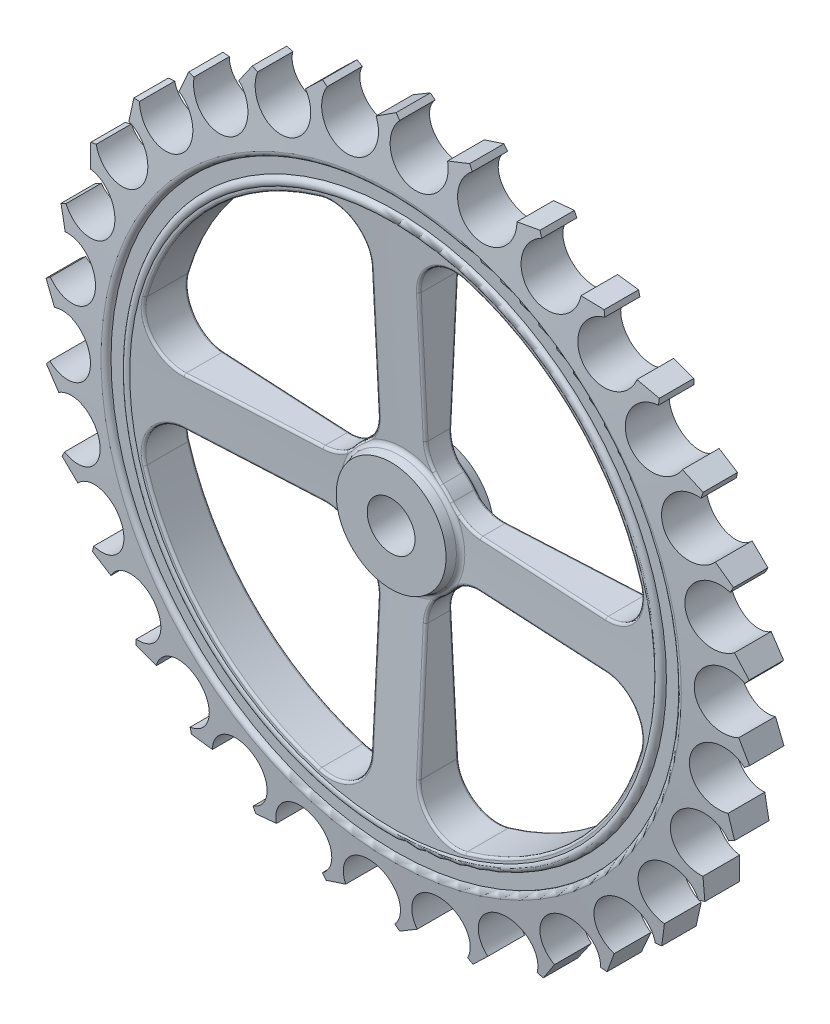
SolidWorks part; units mm, degrees
ref_plane "Спереди" through (0, 0, 0) normal (0, 0, 1) x (1, 0, 0)
ref_plane "Сверху" through (0, 0, 0) normal (0, 1, 0) x (1, 0, 0)
ref_plane "Справа" through (0, 0, 0) normal (1, 0, 0) x (0, 0, -1)
sketch "Эскиз3" plane through (0, 0, 0) normal (1, 0, 0) x (0, 0, -1)
  line L0 (-28.3366, 0) -> (46.3149, 0) construction
  line L1 (5, 5) -> (-5, 5)
  line L2 (0, 5) -> (0, 73.99) construction
  line L3 (-3.6, 73.99) -> (3.6, 73.99)
  line L4 (3.6, 73.99) -> (4.9945, 60.722)
  line L5 (4, 59.6175) -> (4, 56.6175)
  line L6 (5, 5) -> (5, 11.5)
  line L7 (5, 11.5) -> (3.2898, 11.9583)
  line L8 (2.5499, 12.9765) -> (4.75, 54.956)
  line L9 (5, 55.6175) -> (5, 53.7135) construction
  line L10 (4.75, 55.6175) -> (4.75, 53.7135) construction
  line L11 (-3.6, 73.99) -> (-4.9945, 60.722)
  line L12 (-4, 59.6175) -> (-4, 56.6175)
  line L13 (-2.5499, 12.9765) -> (-4.75, 54.956)
  line L14 (-5, 11.5) -> (-3.2898, 11.9583)
  line L15 (-5, 5) -> (-5, 11.5)
  arc A0 (4, 59.6175) -> (4.9945, 60.722) centre (4, 60.6175) ccw
  arc A1 (4.75, 54.956) -> (4, 56.6175) centre (4, 55.6175) ccw
  arc A2 (2.5499, 12.9765) -> (3.2898, 11.9583) centre (3.5486, 12.9242) ccw
  arc A3 (-4, 59.6175) -> (-4.9945, 60.722) centre (-4, 60.6175) cw
  arc A4 (-4.75, 54.956) -> (-4, 56.6175) centre (-4, 55.6175) cw
  arc A5 (-2.5499, 12.9765) -> (-3.2898, 11.9583) centre (-3.5486, 12.9242) cw
  dimension "D8" = 2
  dimension "D13" = 2
  dimension "D1" = 73.99
  dimension "D2" = 5
  dimension "D3" = 6
  dimension "D4" = 3.6
  dimension "D5" = 5
  dimension "D6" = 4
  dimension "D7" = 3
  dimension "D9" = 6.5
  dimension "D10" = 15
  dimension "D11" = 3
  dimension "D12" = 0.25
revolve "Повернуть1" add sketch "Эскиз3" angle 360 about L0
sketch "Эскиз4" plane through (0, 0, 0) normal (0, 0, 1) x (1, 0, 0)
  line L0 (0, 93.8581) -> (0, -85.0976) construction
  line L1 (-81.3467, 0) -> (83.0773, 0) construction
  line L2 (5, 44.1248) -> (5, 16.4924)
  line L3 (16.4924, 5) -> (44.1248, 5)
  line L4 (44.1248, -5) -> (16.4924, -5)
  line L5 (5, -16.4924) -> (5, -44.1248)
  line L6 (-5, -44.1248) -> (-5, -16.4924)
  line L7 (-16.4924, -5) -> (-44.1248, -5)
  line L8 (-44.1248, 5) -> (-16.4924, 5)
  line L9 (-5, 16.4924) -> (-5, 44.1248)
  arc A1 (51.7987, 15.2609) -> (15.2609, 51.7987) centre (0, 0) ccw
  arc A2 (10.2096, 8.0476) -> (8.0476, 10.2096) centre (0, 0) ccw
  arc A3 (5, 44.1248) -> (15.2609, 51.7987) centre (13, 44.1248) cw
  arc A4 (44.1248, 5) -> (51.7987, 15.2609) centre (44.1248, 13) ccw
  arc A5 (16.4924, 5) -> (10.2096, 8.0476) centre (16.4924, 13) cw
  arc A6 (5, 16.4924) -> (8.0476, 10.2096) centre (13, 16.4924) ccw
  arc A7 (15.2609, -51.7987) -> (51.7987, -15.2609) centre (0, 0) ccw
  arc A8 (8.0476, -10.2096) -> (10.2096, -8.0476) centre (0, 0) ccw
  arc A9 (44.1248, -5) -> (51.7987, -15.2609) centre (44.1248, -13) cw
  arc A10 (5, -44.1248) -> (15.2609, -51.7987) centre (13, -44.1248) ccw
  arc A11 (5, -16.4924) -> (8.0476, -10.2096) centre (13, -16.4924) cw
  arc A12 (16.4924, -5) -> (10.2096, -8.0476) centre (16.4924, -13) ccw
  arc A13 (-51.7987, -15.2609) -> (-15.2609, -51.7987) centre (0, 0) ccw
  arc A14 (-10.2096, -8.0476) -> (-8.0476, -10.2096) centre (0, 0) ccw
  arc A15 (-5, -44.1248) -> (-15.2609, -51.7987) centre (-13, -44.1248) cw
  arc A16 (-44.1248, -5) -> (-51.7987, -15.2609) centre (-44.1248, -13) ccw
  arc A17 (-16.4924, -5) -> (-10.2096, -8.0476) centre (-16.4924, -13) cw
  arc A18 (-5, -16.4924) -> (-8.0476, -10.2096) centre (-13, -16.4924) ccw
  arc A19 (-15.2609, 51.7987) -> (-51.7987, 15.2609) centre (0, 0) ccw
  arc A20 (-8.0476, 10.2096) -> (-10.2096, 8.0476) centre (0, 0) ccw
  arc A21 (-44.1248, 5) -> (-51.7987, 15.2609) centre (-44.1248, 13) cw
  arc A22 (-5, 44.1248) -> (-15.2609, 51.7987) centre (-13, 44.1248) ccw
  arc A23 (-5, 16.4924) -> (-8.0476, 10.2096) centre (-13, 16.4924) cw
  arc A24 (-16.4924, 5) -> (-10.2096, 8.0476) centre (-16.4924, 13) ccw
  point P16 (53.768, 5)
  dimension "D3" = 54
  dimension "D4" = 26
  dimension "D5" = 8
  dimension "D1" = 10
  dimension "D2" = 10
  dimension "D7" = 10
  dimension "D6" = 4
extrude "Вырез-Вытянуть1" cut sketch "Эскиз4" against normal mid plane 10
fillet "Скругление1" radius 0.5 64 edges at (-50.1149, 7.6972, -4.5271) (-38.1838, 38.1838, -4.6999) (-8.7685, 50.9141, -4.5775) (-6.2511, 12.1968, -2.5881) (-9.1924, 9.1924, -2.5512) (-13.8449, 5.4508, -2.6497) (-7.6972, -50.1149, -4.5271) (-38.1838, -38.1838, -4.6999) (-50.9141, -8.7685, -4.5775) (-12.1968, -6.2511, -2.5881) (-9.1924, -9.1924, -2.5512) (-5.4508, -13.8449, -2.6497) (50.1149, -7.6972, -4.5271) (38.1838, -38.1838, -4.6999) (8.7685, -50.9141, -4.5775) (6.2511, -12.1968, -2.5881) (9.1924, -9.1924, -2.5512) (13.8449, -5.4508, -2.6497) (12.1968, 6.2511, -2.5881) (9.1924, 9.1924, -2.5512) (5.4508, 13.8449, -2.6497) (7.6972, 50.1149, -4.5271) (38.1838, 38.1838, -4.6999) (50.9141, 8.7685, -4.5775) (-12.1968, 6.2511, 2.5881) (-9.1924, 9.1924, 2.5512) (-5.4508, 13.8449, 2.6497) (-7.6972, 50.1149, 4.5271) (-38.1838, 38.1838, 4.6999) (-50.9141, 8.7685, 4.5775) (-6.2511, -12.1968, 2.5881) (-9.1924, -9.1924, 2.5512) (-13.8449, -5.4508, 2.6497) (-50.1149, -7.6972, 4.5271) (-38.1838, -38.1838, 4.6999) (-8.7685, -50.9141, 4.5775) (12.1968, -6.2511, 2.5881) (9.1924, -9.1924, 2.5512) (5.4508, -13.8449, 2.6497) (7.6972, -50.1149, 4.5271) (38.1838, -38.1838, 4.6999) (50.9141, -8.7685, 4.5775) (6.2511, 12.1968, 2.5881) (9.1924, 9.1924, 2.5512) (13.8449, 5.4508, 2.6497) (50.1149, 7.6972, 4.5271) (38.1838, 38.1838, 4.6999) (8.7685, 50.9141, 4.5775)
sketch "Эскиз5" plane through (0, 0, 0) normal (0, 0, 1) x (1, 0, 0)
  line L0 (0, 97.8533) -> (0, 0) construction
  line L1 (0, 0) -> (87.1109, 0) construction
  line L2 (0, 0) -> (-30.4959, 84.244) construction
  line L3 (-23.477, 64.8545) -> (-3.7919, 83.798) construction
  line L4 (-19.0857, 69.0804) -> (-15.7448, 72.2954)
  line L5 (-15.7448, 72.2954) -> (-14.6943, 71.5841)
  line L6 (-4.306, 71.5389) -> (-0.3697, 73.9891)
  line L7 (-0.3697, 73.9891) -> (0.51, 73.0749)
  line L8 (10.6618, 70.8709) -> (15.0216, 72.4491)
  line L9 (15.0216, 72.4491) -> (15.692, 71.372)
  line L10 (25.1637, 67.1055) -> (29.7563, 67.7428)
  line L11 (29.7563, 67.7428) -> (30.1882, 66.5498)
  line L12 (38.5659, 60.4072) -> (43.1906, 60.0757)
  line L13 (43.1906, 60.0757) -> (43.365, 58.8191)
  line L14 (50.2825, 51.0689) -> (54.7372, 49.7831)
  line L15 (54.7372, 49.7831) -> (54.6465, 48.5177)
  line L16 (59.8015, 39.4986) -> (63.8916, 37.3147)
  line L17 (63.8916, 37.3147) -> (63.5397, 36.0958)
  line L18 (66.7069, 26.202) -> (70.2535, 23.2155)
  line L19 (70.2535, 23.2155) -> (69.656, 22.0964)
  line L20 (70.6969, 11.7603) -> (73.5451, 8.1016)
  line L21 (73.5451, 8.1016) -> (72.7279, 7.1312)
  line L22 (71.5971, -3.1954) -> (73.6224, -7.3663)
  line L23 (73.6224, -7.3663) -> (72.6213, -8.1456)
  line L24 (69.3682, -18.0115) -> (70.482, -22.5123)
  line L25 (70.482, -22.5123) -> (69.3408, -23.0664)
  line L26 (64.1075, -32.0403) -> (64.2613, -36.6744)
  line L27 (64.2613, -36.6744) -> (63.0298, -36.9791)
  line L28 (56.0451, -44.6689) -> (55.232, -49.2336)
  line L29 (55.232, -49.2336) -> (53.964, -49.2757)
  line L30 (45.5332, -55.3452) -> (43.7888, -59.6411)
  line L31 (43.7888, -59.6411) -> (42.5398, -59.4186)
  line L32 (33.0313, -63.6026) -> (30.4318, -67.442)
  line L33 (30.4318, -67.442) -> (29.2564, -66.9647)
  line L34 (19.0857, -69.0804) -> (15.7448, -72.2954)
  line L35 (15.7448, -72.2954) -> (14.6943, -71.5841)
  line L36 (4.306, -71.5389) -> (0.3697, -73.9891)
  line L37 (0.3697, -73.9891) -> (-0.51, -73.0749)
  line L38 (-10.6618, -70.8709) -> (-15.0216, -72.4491)
  line L39 (-15.0216, -72.4491) -> (-15.692, -71.372)
  line L40 (-25.1637, -67.1055) -> (-29.7563, -67.7428)
  line L41 (-29.7563, -67.7428) -> (-30.1882, -66.5498)
  line L42 (-38.5659, -60.4072) -> (-43.1906, -60.0757)
  line L43 (-43.1906, -60.0757) -> (-43.365, -58.8191)
  line L44 (-50.2825, -51.0689) -> (-54.7372, -49.7831)
  line L45 (-54.7372, -49.7831) -> (-54.6465, -48.5177)
  line L46 (-59.8015, -39.4986) -> (-63.8916, -37.3147)
  line L47 (-63.8916, -37.3147) -> (-63.5397, -36.0958)
  line L48 (-66.7069, -26.202) -> (-70.2535, -23.2155)
  line L49 (-70.2535, -23.2155) -> (-69.656, -22.0964)
  line L50 (-70.6969, -11.7603) -> (-73.5451, -8.1016)
  line L51 (-73.5451, -8.1016) -> (-72.7279, -7.1312)
  line L52 (-71.5971, 3.1954) -> (-73.6224, 7.3663)
  line L53 (-73.6224, 7.3663) -> (-72.6213, 8.1456)
  line L54 (-69.3682, 18.0115) -> (-70.482, 22.5123)
  line L55 (-70.482, 22.5123) -> (-69.3408, 23.0664)
  line L56 (-64.1075, 32.0403) -> (-64.2613, 36.6744)
  line L57 (-64.2613, 36.6744) -> (-63.0298, 36.9791)
  line L58 (-56.0451, 44.6689) -> (-55.232, 49.2336)
  line L59 (-55.232, 49.2336) -> (-53.964, 49.2757)
  line L60 (-45.5332, 55.3452) -> (-43.7888, 59.6411)
  line L61 (-43.7888, 59.6411) -> (-42.5398, 59.4186)
  line L62 (-33.0313, 63.6026) -> (-30.4318, 67.442)
  line L63 (-30.4318, 67.442) -> (-29.2564, 66.9647)
  circle A0 centre (0, 0) radius 69.215 construction
  arc A1 (-29.2564, 66.9647) -> (-19.0857, 69.0804) centre (-23.5594, 65.082) ccw
  circle A2 centre (0, 0) radius 73.99 construction
  arc A3 (-14.6943, 71.5841) -> (-4.306, 71.5389) centre (-9.5132, 68.5581) ccw
  arc A4 (0.51, 73.0749) -> (10.6618, 70.8709) centre (4.9487, 69.0379) ccw
  arc A5 (15.692, 71.372) -> (25.1637, 67.1055) centre (19.1943, 66.5003) ccw
  arc A6 (30.1882, 66.5498) -> (38.5659, 60.4072) centre (32.6011, 61.0564) ccw
  arc A7 (43.365, 58.8191) -> (50.2825, 51.0689) centre (44.583, 52.944) ccw
  arc A8 (54.6465, 48.5177) -> (59.8015, 39.4986) centre (54.6165, 42.5178) ccw
  arc A9 (63.5397, 36.0958) -> (66.7069, 26.202) centre (62.2629, 30.2332) ccw
  arc A10 (69.656, 22.0964) -> (70.6969, 11.7603) centre (67.1881, 16.6274) ccw
  arc A11 (72.7279, 7.1312) -> (71.5971, -3.1954) centre (69.1769, 2.2948) ccw
  arc A12 (72.6213, -8.1456) -> (69.3682, -18.0115) centre (68.1424, -12.138) ccw
  arc A13 (69.3408, -23.0664) -> (64.1075, -32.0403) centre (64.1297, -26.0404) ccw
  arc A14 (63.0298, -36.9791) -> (56.0451, -44.6689) centre (57.3142, -38.8046) ccw
  arc A15 (53.964, -49.2757) -> (45.5332, -55.3452) centre (47.9938, -49.8729) ccw
  arc A16 (42.5398, -59.4186) -> (33.0313, -63.6026) centre (36.5759, -58.7616) ccw
  arc A17 (29.2564, -66.9647) -> (19.0857, -69.0804) centre (23.5594, -65.082) ccw
  arc A18 (14.6943, -71.5841) -> (4.306, -71.5389) centre (9.5132, -68.5581) ccw
  arc A19 (-0.51, -73.0749) -> (-10.6618, -70.8709) centre (-4.9487, -69.0379) ccw
  arc A20 (-15.692, -71.372) -> (-25.1637, -67.1055) centre (-19.1943, -66.5003) ccw
  arc A21 (-30.1882, -66.5498) -> (-38.5659, -60.4072) centre (-32.6011, -61.0564) ccw
  arc A22 (-43.365, -58.8191) -> (-50.2825, -51.0689) centre (-44.583, -52.944) ccw
  arc A23 (-54.6465, -48.5177) -> (-59.8015, -39.4986) centre (-54.6165, -42.5178) ccw
  arc A24 (-63.5397, -36.0958) -> (-66.7069, -26.202) centre (-62.2629, -30.2332) ccw
  arc A25 (-69.656, -22.0964) -> (-70.6969, -11.7603) centre (-67.1881, -16.6274) ccw
  arc A26 (-72.7279, -7.1312) -> (-71.5971, 3.1954) centre (-69.1769, -2.2948) ccw
  arc A27 (-72.6213, 8.1456) -> (-69.3682, 18.0115) centre (-68.1424, 12.138) ccw
  arc A28 (-69.3408, 23.0664) -> (-64.1075, 32.0403) centre (-64.1297, 26.0404) ccw
  arc A29 (-63.0298, 36.9791) -> (-56.0451, 44.6689) centre (-57.3142, 38.8046) ccw
  arc A30 (-53.964, 49.2757) -> (-45.5332, 55.3452) centre (-47.9938, 49.8729) ccw
  arc A31 (-42.5398, 59.4186) -> (-33.0313, 63.6026) centre (-36.5759, 58.7616) ccw
  dimension "D1" = 138.43
  dimension "D3" = 12
  dimension "D2" = 66
  dimension "D4" = 63.01
  dimension "D5" = 102
  dimension "D6" = 30
  dimension "D7" = 19.9
  dimension "D8" = 12
extrude "Вырез-Вытянуть2" cut sketch "Эскиз5" against normal mid plane 10 flip side to cut
